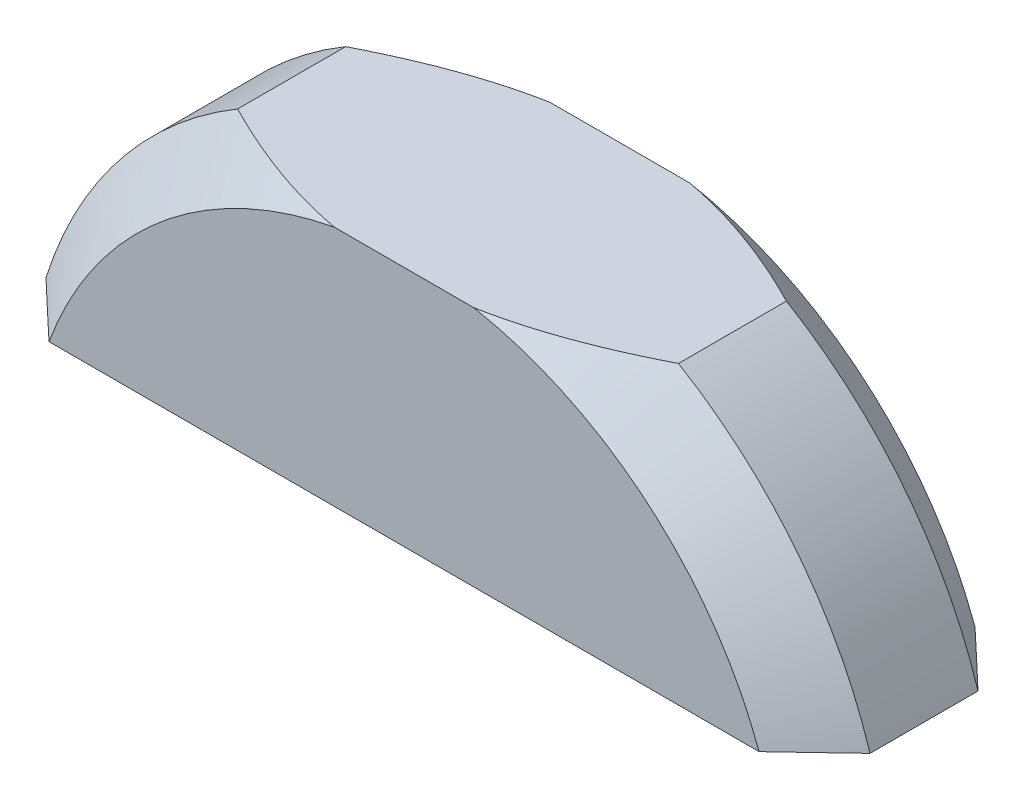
SolidWorks part; units mm, degrees
ref_plane "front" through (0, 0, 0) normal (0, 0, 1) x (1, 0, 0)
ref_plane "top" through (0, 0, 0) normal (0, 1, 0) x (1, 0, 0)
ref_plane "right" through (0, 0, 0) normal (1, 0, 0) x (0, 0, -1)
other "Configuration Table"
sketch "body" plane through (0, 0, 0) normal (0, 0, 1) x (1, 0, 0)
  line L0 (-1.9079, 0.6) -> (1.9079, 0.6)
  line L1 (-1.0206, 1.72) -> (1.0206, 1.72)
  arc A0 (-1.9079, 0.6) -> (-1.0206, 1.72) centre (0, 0) cw
  arc A1 (1.0206, 1.72) -> (1.9079, 0.6) centre (0, 0) cw
extrude "Extrude1" add sketch "body" along normal blind 1
chamfer "Chamfer1" distance 0.25 6 edges at (-1.5677, 1.2419, 0) (0, 1.72, 0) (1.5677, 1.2419, 0) (1.5677, 1.2419, 1) (0, 1.72, 1) (-1.5677, 1.2419, 1)
equation "\"Height2@body\" = \"Height@body\" * 4 / 5"
